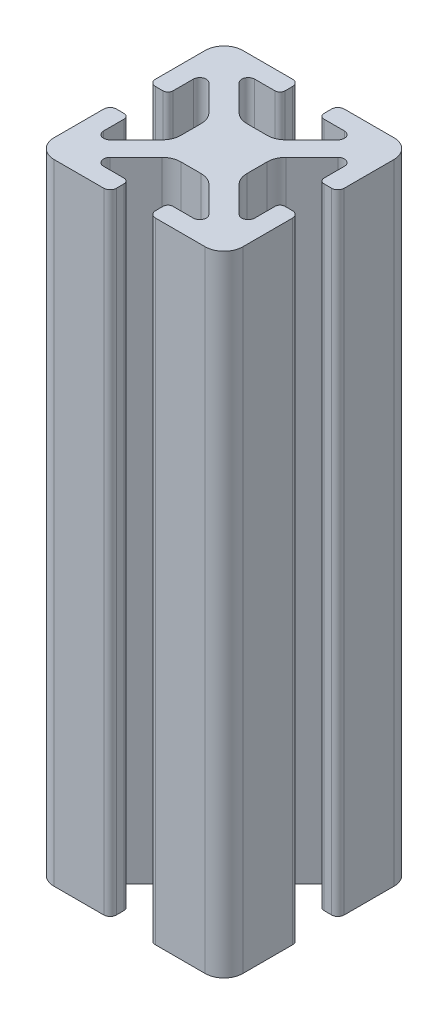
SolidWorks part; units mm, degrees
ref_plane "Front Plane" through (0, 0, 0) normal (0, 0, 1) x (1, 0, 0)
ref_plane "Top Plane" through (0, 0, 0) normal (0, 1, 0) x (1, 0, 0)
ref_plane "Right Plane" through (0, 0, 0) normal (1, 0, 0) x (0, 0, -1)
imported_body "item_0041901_Profile_6_30x30_L=20_1.stp"
sketch "Sketch1" plane through (0, 10, 0) normal (0, 1, 0) x (1, 0, 0)
  line L36 (3.1, 14) -> (3.1, 12.8)
  line L37 (3.9, 12) -> (7.1276, 12)
  line L38 (7.8506, 10.2547) -> (3.7245, 6.1287)
  line L39 (1.6032, 5.25) -> (-1.6032, 5.25)
  line L40 (-3.7245, 6.1287) -> (-7.8506, 10.2547)
  line L41 (-7.1276, 12) -> (-3.9, 12)
  line L42 (-3.1, 12.8) -> (-3.1, 14)
  line L43 (-4.1, 15) -> (-12, 15)
  line L44 (-15, 12) -> (-15, 4.1)
  line L45 (-14, 3.1) -> (-12.8, 3.1)
  line L46 (-12, 3.9) -> (-12, 7.1276)
  line L47 (-10.2547, 7.8506) -> (-6.1287, 3.7245)
  line L48 (-5.25, 1.6032) -> (-5.25, -1.6032)
  line L49 (-6.1287, -3.7245) -> (-10.2547, -7.8506)
  line L50 (-12, -7.1276) -> (-12, -3.9)
  line L51 (-12.8, -3.1) -> (-14, -3.1)
  line L52 (-15, -4.1) -> (-15, -12)
  line L53 (-12, -15) -> (-4.1, -15)
  line L54 (-3.1, -14) -> (-3.1, -12.8)
  line L55 (-3.9, -12) -> (-7.1276, -12)
  line L56 (-7.8506, -10.2547) -> (-3.7245, -6.1287)
  line L57 (-1.6032, -5.25) -> (1.6032, -5.25)
  line L58 (3.7245, -6.1287) -> (7.8506, -10.2547)
  line L59 (7.1276, -12) -> (3.9, -12)
  line L60 (3.1, -12.8) -> (3.1, -14)
  line L61 (4.1, -15) -> (12, -15)
  line L62 (15, -12) -> (15, -4.1)
  line L63 (14, -3.1) -> (12.8, -3.1)
  line L64 (12, -3.9) -> (12, -7.1276)
  line L65 (10.2547, -7.8506) -> (6.1287, -3.7245)
  line L66 (5.25, -1.6032) -> (5.25, 1.6032)
  line L67 (6.1287, 3.7245) -> (10.2547, 7.8506)
  line L68 (12, 7.1276) -> (12, 3.9)
  line L69 (12.8, 3.1) -> (14, 3.1)
  line L70 (15, 4.1) -> (15, 12)
  line L71 (12, 15) -> (4.1, 15)
  line L72 (3.1, 14) -> (3.1, 12.8)
  line L73 (3.9, 12) -> (7.1276, 12)
  line L74 (7.8506, 10.2547) -> (3.7245, 6.1287)
  line L75 (1.6032, 5.25) -> (-1.6032, 5.25)
  line L76 (-3.7245, 6.1287) -> (-7.8506, 10.2547)
  line L77 (-7.1276, 12) -> (-3.9, 12)
  line L78 (-3.1, 12.8) -> (-3.1, 14)
  line L79 (-4.1, 15) -> (-12, 15)
  line L80 (-15, 12) -> (-15, 4.1)
  line L81 (-14, 3.1) -> (-12.8, 3.1)
  line L82 (-12, 3.9) -> (-12, 7.1276)
  line L83 (-10.2547, 7.8506) -> (-6.1287, 3.7245)
  line L84 (-5.25, 1.6032) -> (-5.25, -1.6032)
  line L85 (-6.1287, -3.7245) -> (-10.2547, -7.8506)
  line L86 (-12, -7.1276) -> (-12, -3.9)
  line L87 (-12.8, -3.1) -> (-14, -3.1)
  line L88 (-15, -4.1) -> (-15, -12)
  line L89 (-12, -15) -> (-4.1, -15)
  line L90 (-3.1, -14) -> (-3.1, -12.8)
  line L91 (-3.9, -12) -> (-7.1276, -12)
  line L92 (-7.8506, -10.2547) -> (-3.7245, -6.1287)
  line L93 (-1.6032, -5.25) -> (1.6032, -5.25)
  line L94 (3.7245, -6.1287) -> (7.8506, -10.2547)
  line L95 (7.1276, -12) -> (3.9, -12)
  line L96 (3.1, -12.8) -> (3.1, -14)
  line L97 (4.1, -15) -> (12, -15)
  line L98 (15, -12) -> (15, -4.1)
  line L99 (14, -3.1) -> (12.8, -3.1)
  line L100 (12, -3.9) -> (12, -7.1276)
  line L101 (10.2547, -7.8506) -> (6.1287, -3.7245)
  line L102 (5.25, -1.6032) -> (5.25, 1.6032)
  line L103 (6.1287, 3.7245) -> (10.2547, 7.8506)
  line L104 (12, 7.1276) -> (12, 3.9)
  line L105 (12.8, 3.1) -> (14, 3.1)
  line L106 (15, 4.1) -> (15, 12)
  line L107 (12, 15) -> (4.1, 15)
  arc A36 (4.1, 15) -> (3.1, 14) centre (4.1, 14) ccw
  arc A37 (3.1, 12.8) -> (3.9, 12) centre (3.9, 12.8) ccw
  arc A38 (7.8506, 10.2547) -> (7.1276, 12) centre (7.1276, 10.9776) ccw
  arc A39 (1.6032, 5.25) -> (3.7245, 6.1287) centre (1.6032, 8.25) ccw
  arc A40 (-3.7245, 6.1287) -> (-1.6032, 5.25) centre (-1.6032, 8.25) ccw
  arc A41 (-7.1276, 12) -> (-7.8506, 10.2547) centre (-7.1276, 10.9776) ccw
  arc A42 (-3.9, 12) -> (-3.1, 12.8) centre (-3.9, 12.8) ccw
  arc A43 (-3.1, 14) -> (-4.1, 15) centre (-4.1, 14) ccw
  arc A44 (-12, 15) -> (-15, 12) centre (-12, 12) ccw
  arc A45 (-15, 4.1) -> (-14, 3.1) centre (-14, 4.1) ccw
  arc A46 (-12.8, 3.1) -> (-12, 3.9) centre (-12.8, 3.9) ccw
  arc A47 (-10.2547, 7.8506) -> (-12, 7.1276) centre (-10.9776, 7.1276) ccw
  arc A48 (-5.25, 1.6032) -> (-6.1287, 3.7245) centre (-8.25, 1.6032) ccw
  arc A49 (-6.1287, -3.7245) -> (-5.25, -1.6032) centre (-8.25, -1.6032) ccw
  arc A50 (-12, -7.1276) -> (-10.2547, -7.8506) centre (-10.9776, -7.1276) ccw
  arc A51 (-12, -3.9) -> (-12.8, -3.1) centre (-12.8, -3.9) ccw
  arc A52 (-14, -3.1) -> (-15, -4.1) centre (-14, -4.1) ccw
  arc A53 (-15, -12) -> (-12, -15) centre (-12, -12) ccw
  arc A54 (-4.1, -15) -> (-3.1, -14) centre (-4.1, -14) ccw
  arc A55 (-3.1, -12.8) -> (-3.9, -12) centre (-3.9, -12.8) ccw
  arc A56 (-7.8506, -10.2547) -> (-7.1276, -12) centre (-7.1276, -10.9776) ccw
  arc A57 (-1.6032, -5.25) -> (-3.7245, -6.1287) centre (-1.6032, -8.25) ccw
  arc A58 (3.7245, -6.1287) -> (1.6032, -5.25) centre (1.6032, -8.25) ccw
  arc A59 (7.1276, -12) -> (7.8506, -10.2547) centre (7.1276, -10.9776) ccw
  arc A60 (3.9, -12) -> (3.1, -12.8) centre (3.9, -12.8) ccw
  arc A61 (3.1, -14) -> (4.1, -15) centre (4.1, -14) ccw
  arc A62 (12, -15) -> (15, -12) centre (12, -12) ccw
  arc A63 (15, -4.1) -> (14, -3.1) centre (14, -4.1) ccw
  arc A64 (12.8, -3.1) -> (12, -3.9) centre (12.8, -3.9) ccw
  arc A65 (10.2547, -7.8506) -> (12, -7.1276) centre (10.9776, -7.1276) ccw
  arc A66 (5.25, -1.6032) -> (6.1287, -3.7245) centre (8.25, -1.6032) ccw
  arc A67 (6.1287, 3.7245) -> (5.25, 1.6032) centre (8.25, 1.6032) ccw
  arc A68 (12, 7.1276) -> (10.2547, 7.8506) centre (10.9776, 7.1276) ccw
  arc A69 (12, 3.9) -> (12.8, 3.1) centre (12.8, 3.9) ccw
  arc A70 (14, 3.1) -> (15, 4.1) centre (14, 4.1) ccw
  arc A71 (15, 12) -> (12, 15) centre (12, 12) ccw
  arc A72 (4.1, 15) -> (3.1, 14) centre (4.1, 14) ccw
  arc A73 (3.1, 12.8) -> (3.9, 12) centre (3.9, 12.8) ccw
  arc A74 (7.8506, 10.2547) -> (7.1276, 12) centre (7.1276, 10.9776) ccw
  arc A75 (1.6032, 5.25) -> (3.7245, 6.1287) centre (1.6032, 8.25) ccw
  arc A76 (-3.7245, 6.1287) -> (-1.6032, 5.25) centre (-1.6032, 8.25) ccw
  arc A77 (-7.1276, 12) -> (-7.8506, 10.2547) centre (-7.1276, 10.9776) ccw
  arc A78 (-3.9, 12) -> (-3.1, 12.8) centre (-3.9, 12.8) ccw
  arc A79 (-3.1, 14) -> (-4.1, 15) centre (-4.1, 14) ccw
  arc A80 (-12, 15) -> (-15, 12) centre (-12, 12) ccw
  arc A81 (-15, 4.1) -> (-14, 3.1) centre (-14, 4.1) ccw
  arc A82 (-12.8, 3.1) -> (-12, 3.9) centre (-12.8, 3.9) ccw
  arc A83 (-10.2547, 7.8506) -> (-12, 7.1276) centre (-10.9776, 7.1276) ccw
  arc A84 (-5.25, 1.6032) -> (-6.1287, 3.7245) centre (-8.25, 1.6032) ccw
  arc A85 (-6.1287, -3.7245) -> (-5.25, -1.6032) centre (-8.25, -1.6032) ccw
  arc A86 (-12, -7.1276) -> (-10.2547, -7.8506) centre (-10.9776, -7.1276) ccw
  arc A87 (-12, -3.9) -> (-12.8, -3.1) centre (-12.8, -3.9) ccw
  arc A88 (-14, -3.1) -> (-15, -4.1) centre (-14, -4.1) ccw
  arc A89 (-15, -12) -> (-12, -15) centre (-12, -12) ccw
  arc A90 (-4.1, -15) -> (-3.1, -14) centre (-4.1, -14) ccw
  arc A91 (-3.1, -12.8) -> (-3.9, -12) centre (-3.9, -12.8) ccw
  arc A92 (-7.8506, -10.2547) -> (-7.1276, -12) centre (-7.1276, -10.9776) ccw
  arc A93 (-1.6032, -5.25) -> (-3.7245, -6.1287) centre (-1.6032, -8.25) ccw
  arc A94 (3.7245, -6.1287) -> (1.6032, -5.25) centre (1.6032, -8.25) ccw
  arc A95 (7.1276, -12) -> (7.8506, -10.2547) centre (7.1276, -10.9776) ccw
  arc A96 (3.9, -12) -> (3.1, -12.8) centre (3.9, -12.8) ccw
  arc A97 (3.1, -14) -> (4.1, -15) centre (4.1, -14) ccw
  arc A98 (12, -15) -> (15, -12) centre (12, -12) ccw
  arc A99 (15, -4.1) -> (14, -3.1) centre (14, -4.1) ccw
  arc A100 (12.8, -3.1) -> (12, -3.9) centre (12.8, -3.9) ccw
  arc A101 (10.2547, -7.8506) -> (12, -7.1276) centre (10.9776, -7.1276) ccw
  arc A102 (5.25, -1.6032) -> (6.1287, -3.7245) centre (8.25, -1.6032) ccw
  arc A103 (6.1287, 3.7245) -> (5.25, 1.6032) centre (8.25, 1.6032) ccw
  arc A104 (12, 7.1276) -> (10.2547, 7.8506) centre (10.9776, 7.1276) ccw
  arc A105 (12, 3.9) -> (12.8, 3.1) centre (12.8, 3.9) ccw
  arc A106 (14, 3.1) -> (15, 4.1) centre (14, 4.1) ccw
  arc A107 (15, 12) -> (12, 15) centre (12, 12) ccw
  dimension "D1" = 0
extrude "Boss-Extrude1" add sketch "Sketch1" along normal blind 80
